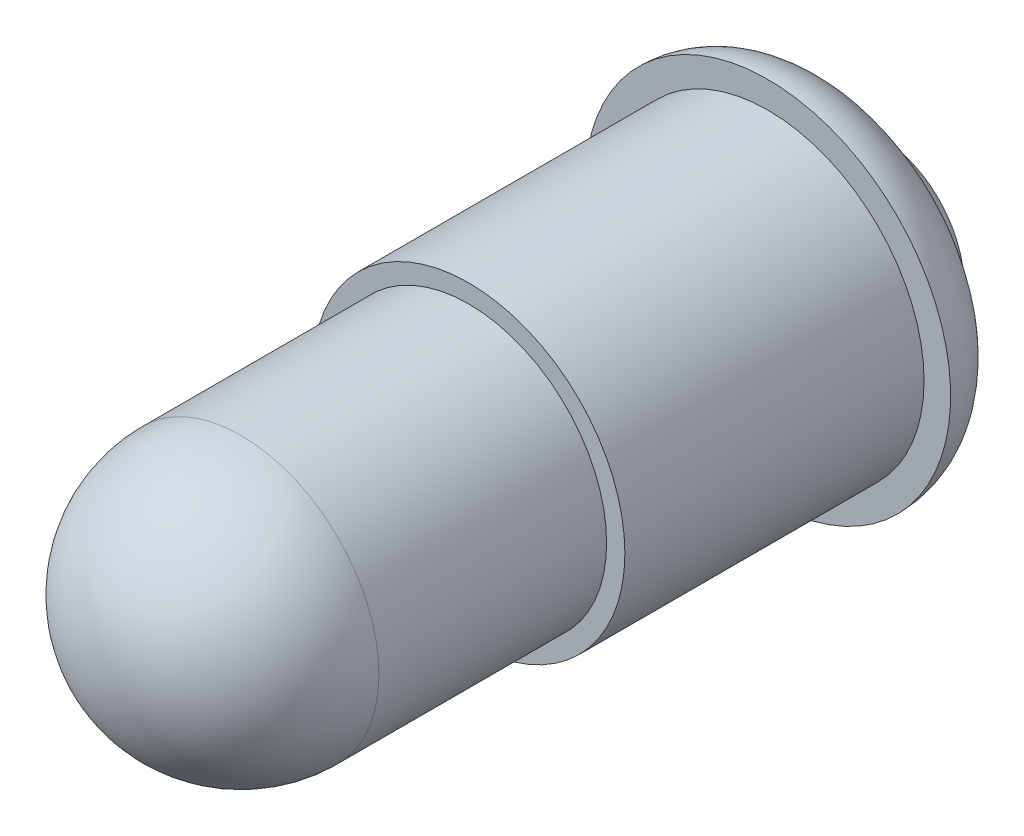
SolidWorks part; units mm, degrees
ref_plane "Face" through (0, 0, 0) normal (0, 0, 1) x (1, 0, 0)
ref_plane "Dessus" through (0, 0, 0) normal (0, 1, 0) x (1, 0, 0)
ref_plane "Droite" through (0, 0, 0) normal (1, 0, 0) x (0, 0, -1)
sketch "Esquisse1" plane through (0, 0, 0) normal (0, 0, 1) x (1, 0, 0)
  circle A0 centre (0, 0) radius 2.35
  dimension "D1" = 4.7
extrude "Extrusion1" add sketch "Esquisse1" along normal blind 4.5
sketch "Esquisse2" plane through (0, 0, 4.5) normal (0, 0, 1) x (1, 0, 0)
  circle A0 centre (0, 0) radius 2.075
  circle A1 centre (0, 0) radius 2.35 construction
  dimension "D1" = 4.15
extrude "Extrusion2" add sketch "Esquisse2" along normal blind 5.5
fillet "Congé1" radius 2.075
sketch "Esquisse3" plane through (0, 0, 0) normal (0, 0, -1) x (-1, 0, 0)
  circle A0 centre (0, 0) radius 2.75
  dimension "D1" = 5.5
extrude "Extrusion3" add sketch "Esquisse3" along normal blind 1
fillet "Congé2" radius 1
sketch "Esquisse4" plane through (0, 0, -1) normal (0, 0, -1) x (-1, 0, 0)
  circle A0 centre (0, 0) radius 1.75
extrude "Extrusion4" add sketch "Esquisse4" along normal blind 0.25
chamfer "Chanfrein1" distance 0.25 angle 45
sketch "Esquisse6" plane through (0, 0, -1.25) normal (0, 0, -1) x (-1, 0, 0)
  circle A0 centre (0, -0.0929) radius 1.5
extrude "Extrusion5" add sketch "Esquisse6" along normal blind 0.5
fillet "Congé3" radius 0.5
